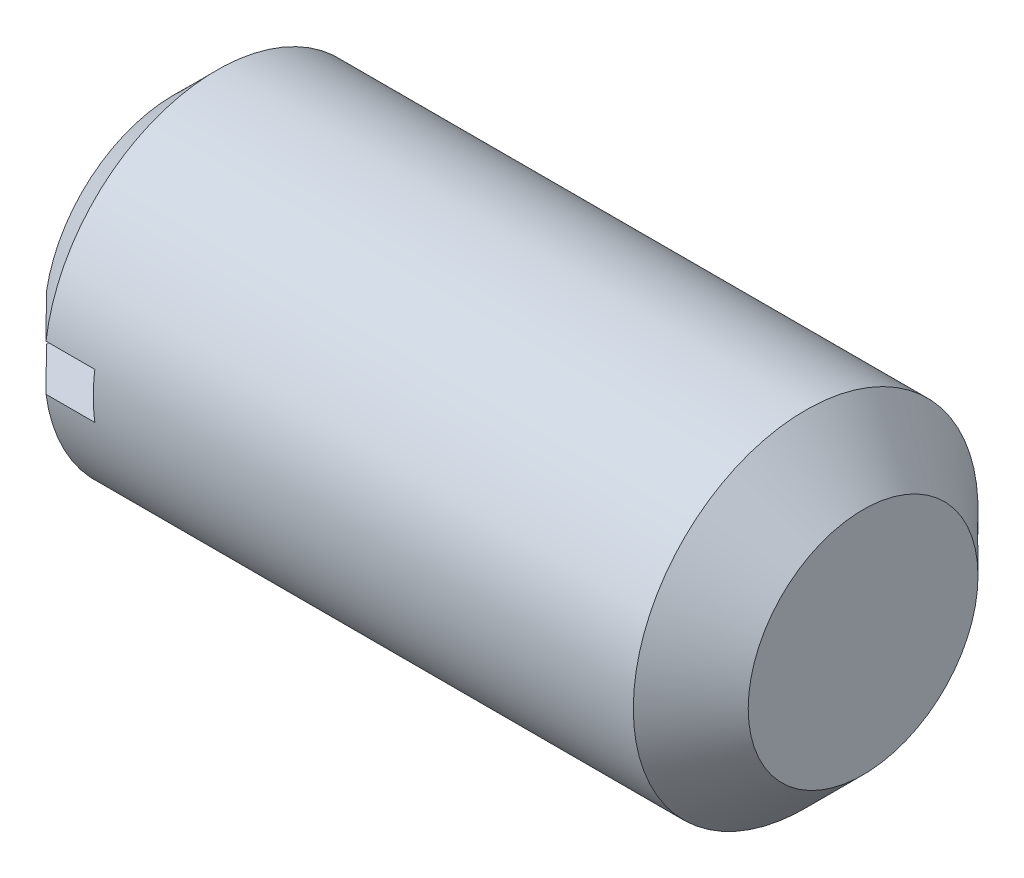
SolidWorks part; units mm, degrees
ref_plane "Front" through (0, 0, 0) normal (0, 0, 1) x (1, 0, 0)
ref_plane "Top" through (0, 0, 0) normal (0, 1, 0) x (1, 0, 0)
ref_plane "Right" through (0, 0, 0) normal (1, 0, 0) x (0, 0, -1)
sketch "Sketch1" plane through (0, 0, 0) normal (0, 0, 1) x (1, 0, 0)
  line L0 (0, 0) -> (6, 0)
  line L1 (6, 0) -> (6, 1)
  line L2 (6, 1) -> (5.5, 1.5)
  line L3 (5.5, 1.5) -> (0.375, 1.5)
  line L4 (0.375, 1.5) -> (0, 1.125)
  line L5 (0, 1.125) -> (0, 0)
  line L6 (-10.745, 0) -> (0.8952, 0) construction
  dimension "D1" = 45
  dimension "l" = 6
  dimension "D2" = 45
  dimension "dp" = 2
  dimension "d" = 3
  dimension "df" = 2.25
revolve "Base" add sketch "Sketch1" angle 360 about L6
sketch "Sketch2" plane through (0, 0, 0) normal (0, 0, 1) x (1, 0, 0)
  line L1 (0, 0.2) -> (0.8, 0.2)
  line L2 (0, 0.2) -> (0, -0.2)
  line L3 (0, -0.2) -> (0.8, -0.2)
  line L4 (0.8, 0.2) -> (0.8, -0.2)
  line L5 (0, 1.125) -> (0, -1.125) construction
  dimension "m" = 0.2
  dimension "n" = 0.4
  dimension "t" = 0.8
extrude "Notch" cut sketch "Sketch2" against normal through all and the other way through all
sketch "Sketch3" plane through (0, 0, 0) normal (0, 0, 1) x (1, 0, 0)
  line L0 (0.375, 1.1752) -> (0.5625, 1.5)
  line L1 (0.5625, 1.5) -> (0.5625, 1.875)
  line L2 (0.5625, 1.875) -> (0.1875, 1.875)
  line L3 (0.1875, 1.875) -> (0.1875, 1.5)
  line L4 (0.1875, 1.5) -> (0.375, 1.1752)
  line L5 (0, 0) -> (1.5288, 0) construction
  line L6 (0.375, 1.5) -> (0.375, 0.2) construction
  dimension "D1" = 3
  dimension "D2" = 0.375
revolve "Cut-Revolve10" [suppressed] cut sketch "Sketch3" angle 360 about L5
pattern_linear "LPattern10" [suppressed] count 13 spacing 0.45 along (1, 0, 0)
equation "\"df@Sketch1\" = \"D2@ThreadCosmetic1\""
equation "\"m@Sketch2\" = \"n@Sketch2\" / 2"
equation "\"D1@Sketch3\" = \"d@Sketch1\""
equation "\"D2@Sketch3\" =  ( \"d@Sketch1\" - \"D2@ThreadCosmetic1\" )  / 2"
equation "\"D3@LPattern10\" = \"D2@Sketch3\" * 1.2"
equation "\"D1@LPattern10\" =  ( \"l@Sketch1\" -  ( \"d@Sketch1\" - \"df@Sketch1\" )  / 2 )  / \"D3@LPattern10\""
